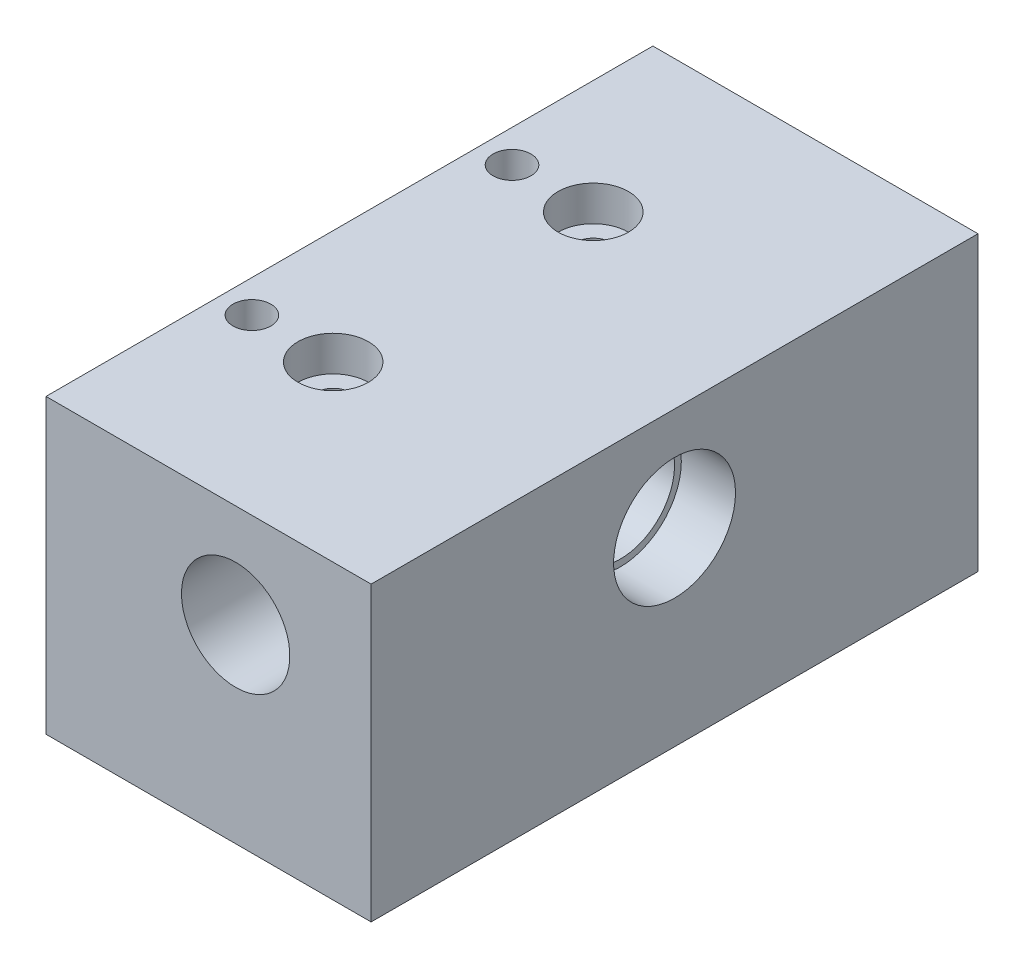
SolidWorks part; units mm, degrees
ref_plane "Plan de face" through (0, 0, 0) normal (0, 0, 1) x (1, 0, 0)
ref_plane "Plan de dessus" through (0, 0, 0) normal (0, 1, 0) x (1, 0, 0)
ref_plane "Plan de droite" through (0, 0, 0) normal (1, 0, 0) x (0, 0, -1)
sketch "Esquisse1" plane through (0, 0, 0) normal (0, 0, 1) x (1, 0, 0)
  line L1 (0, 0) -> (120, 0)
  line L2 (0, 0) -> (0, 108)
  line L3 (0, 108) -> (120, 108)
  line L4 (120, 0) -> (120, 108)
  dimension "D1" = 120
  dimension "D2" = 108
extrude "Extrusion1" add sketch "Esquisse1" along normal blind 112
hole_wizard "Diamètre du perçage M0.15 (0.15)1" positions "Esquisse3" profile "Esquisse2" hole size "M0.15" standard "Ansi Métrique"
sketch "Esquisse3" plane through (0, 0, 0) normal (-1, 0, 0) x (0, 0, 1)
  line L0 (0, 108) -> (0, 0) construction
  line L1 (112, 0) -> (0, 0) construction
  point P0 (80, 70)
  dimension "D1" = 80
  dimension "D2" = 70
sketch "Esquisse2" plane through (0, 70, 80) normal (0, 1, 0) x (0, 0, 1)
  line L0 (0, 0) -> (0, 51.7168)
  line L1 (0, 51.7168) -> (19.5, 40)
  line L2 (19.5, 40) -> (19.5, 0)
  line L5 (19.5, 0) -> (0, 0)
  line L10 (0, 51.7168) -> (-19.5, 40) construction
  line L11 (0, -6.35) -> (0, 107.95) construction
  dimension "Diamètre du perçage" = 39
  dimension "Profondeur du perçage" = 40
  dimension "Angle de pointe" = 118
hole_wizard "Perçage1" positions "Esquisse3D1" profile "Esquisse4" legacy
sketch3d "Esquisse3D1"
  circle A0 centre (0, 70, 80) radius 19.5 construction
  point P0 (0, 70, 80)
  point P5 (-19.5, 70, 80)
sketch "Esquisse4" plane through (0, 70, 80) normal (0, 1, 0) x (0, 0, 1)
  line L0 (0, 0) -> (0, 40)
  line L1 (0, 40) -> (20, 40)
  line L2 (20, 40) -> (20, 0)
  line L3 (20, 0) -> (0, 0)
  line L4 (0, 110) -> (0, -10) construction
  dimension "Diamètre" = 40
  dimension "Profondeur" = 40
sketch "Esquisse5" plane through (0, 0, 0) normal (0, 0, -1) x (-1, 0, 0)
  line L0 (0, 108) -> (0, 0) construction
  line L1 (0, 0) -> (-120, 0) construction
  circle A0 centre (-70, 70) radius 20
  dimension "D1" = 70
  dimension "D2" = 70
extrude "Enlèv. mat.-Extru.1" cut sketch "Esquisse5" against normal through all
hole_wizard "Chambrage pour vis à tête ronde bombée M101" positions "Esquisse7" profile "Esquisse6" counterbore size "M10" standard "Ansi Métrique"
sketch "Esquisse7" plane through (0, 108, 0) normal (0, 1, 0) x (-1, 0, 0)
  line L0 (-120, 0) -> (0, 0) construction
  line L1 (0, 112) -> (0, 0) construction
  point P0 (-42, 48)
  dimension "D1" = 48
  dimension "D2" = 42
sketch "Esquisse6" plane through (42, 108, 48) normal (1, 0, 0) x (0, 0, 1)
  line L0 (0, 0) -> (0, 108)
  line L1 (0, 108) -> (6.5, 108)
  line L3 (6.5, 108) -> (6.5, 13)
  line L4 (6.5, 13) -> (13, 13)
  line L5 (13, 13) -> (13, 0)
  line L7 (13, 0) -> (0, 0)
  line L11 (0, -6.35) -> (0, 107.95) construction
  dimension "Diamètre du perçage jusqu'au prochain" = 13
  dimension "Profondeur du perçage jusqu'au prochain" = 108
  dimension "Diamètre du chambrage" = 26
  dimension "Profondeur du chambrage" = 13
hole_wizard "Diamètre du perçage M14.0 (14)1" positions "Esquisse9" profile "Esquisse8" hole size "M14.0" standard "Ansi Métrique"
sketch "Esquisse9" plane through (0, 108, 0) normal (0, 1, 0) x (-1, 0, 0)
  line L0 (-120, 0) -> (0, 0) construction
  line L1 (0, 112) -> (0, 0) construction
  point P0 (-12, 48)
  dimension "D1" = 48
  dimension "D2" = 12
sketch "Esquisse8" plane through (12, 108, 48) normal (1, 0, 0) x (0, 0, 1)
  line L0 (0, 0) -> (0, 82.206)
  line L1 (0, 82.206) -> (7, 78)
  line L2 (7, 78) -> (7, 0)
  line L5 (7, 0) -> (0, 0)
  line L10 (0, 82.206) -> (-7, 78) construction
  line L11 (0, -6.35) -> (0, 107.95) construction
  dimension "Diamètre du perçage" = 14
  dimension "Profondeur du perçage" = 78
  dimension "Angle de pointe" = 118
hole_wizard "Diamètre du perçage M12.0 (12)1" positions "Esquisse11" profile "Esquisse10" hole size "M12.0" standard "Ansi Métrique"
sketch "Esquisse11" plane through (0, 0, 0) normal (0, -1, 0) x (1, 0, 0)
  circle A0 centre (12, 48) radius 7 construction
  point P0 (12, 48)
sketch "Esquisse10" plane through (12, 0, 48) normal (1, 0, 0) x (0, 0, -1)
  line L0 (0, 0) -> (0, 25.794)
  line L1 (0, 25.794) -> (6, 25.794)
  line L2 (6, 25.794) -> (6, 0)
  line L5 (6, 0) -> (0, 0)
  line L11 (0, -6.35) -> (0, 107.95) construction
  dimension "Diamètre du perçage jusqu'au prochain" = 12
  dimension "Profondeur du perçage jusqu'au prochain" = 25.794
mirror "Symétrie1" about plane through (0, 108, 0) normal (0, 0, -1)
sketch "Esquisse12" plane through (0, 0, 0) normal (-1, 0, 0) x (0, 0, 1)
  line L0 (112, 0) -> (-112, 0) construction
  circle A0 centre (0, 70) radius 20
  dimension "D1" = 70
extrude "Enlèv. mat.-Extru.2" cut sketch "Esquisse12" against normal through all
sketch "Esquisse13" plane through (120, 0, 0) normal (1, 0, 0) x (0, 0, -1)
  circle A0 centre (0, 70) radius 22.5
  circle A1 centre (0, 70) radius 20 construction
extrude "Enlèv. mat.-Extru.3" cut sketch "Esquisse13" against normal blind 20
